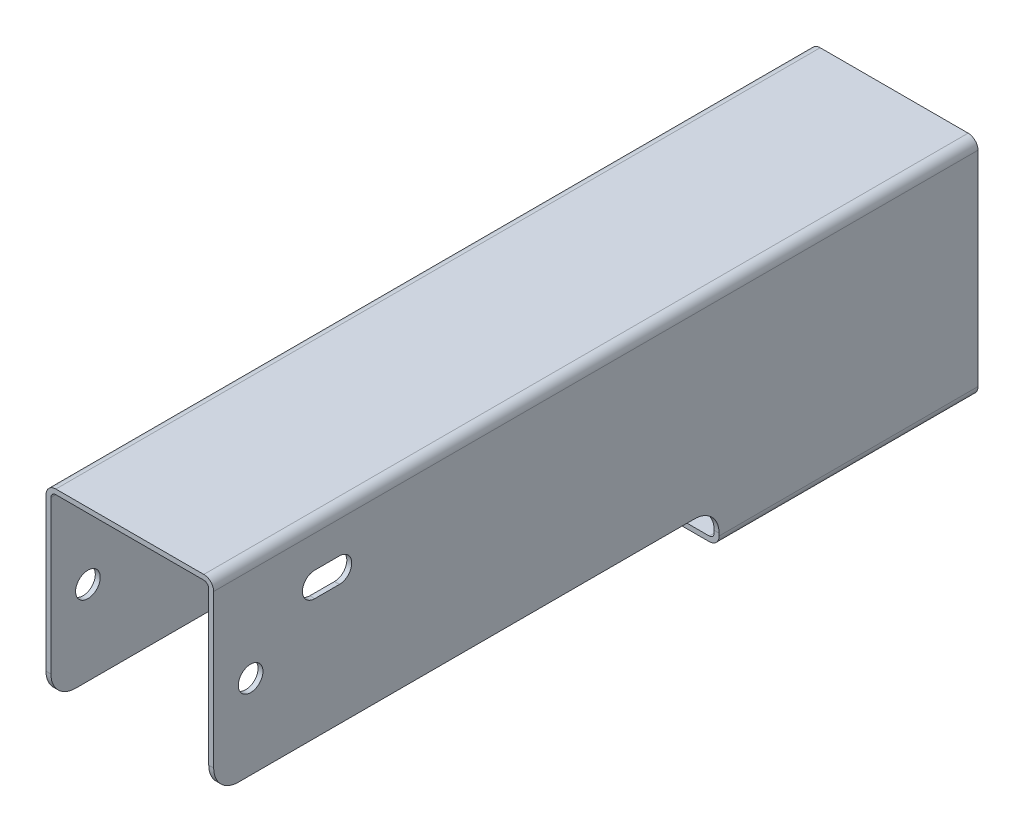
SolidWorks part; units mm, degrees
ref_plane "Plan de face" through (0, 0, 0) normal (0, 0, 1) x (1, 0, 0)
ref_plane "Plan de dessus" through (0, 0, 0) normal (0, 1, 0) x (1, 0, 0)
ref_plane "Plan de droite" through (0, 0, 0) normal (1, 0, 0) x (0, 0, -1)
sketch "Esquisse1" plane through (0, 0, 0) normal (0, 0, 1) x (1, 0, 0)
  line L1 (-32, 0) -> (32, 0)
  line L2 (-32, 0) -> (-32, 2)
  line L3 (-32, 2) -> (32, 2)
  line L4 (32, 0) -> (32, 2)
  dimension "D1" = 2
  dimension "D2" = 64
extrude "Extrusion1" add sketch "Esquisse1" against normal blind 310
sketch "Esquisse2" plane through (0, 2, 0) normal (0, 1, 0) x (-1, 0, 0)
  line L0 (-32, 0) -> (32, 0) construction
  line L1 (-32, 0) -> (-34, 0)
  line L2 (-32, 0) -> (-32, -310)
  line L3 (-32, -310) -> (-34, -310)
  line L4 (-34, 0) -> (-34, -310)
  line L5 (32, -310) -> (34, -310)
  line L6 (32, -310) -> (32, 0)
  line L7 (32, 0) -> (34, 0)
  line L8 (34, -310) -> (34, 0)
  line L11 (-32, -310) -> (32, -310) construction
  dimension "D1" = 2
  dimension "D2" = 2
extrude "Extrusion2" add sketch "Esquisse2" against normal blind 76
fillet "Congé1" radius 2 2 edges
fillet "Congé2" radius 4 2 edges at (34, 2, -155) (-34, 2, -155)
fillet "Congé3" radius 10 2 edges at (-33, -74, 0) (33, -74, 0)
sketch "Esquisse5" plane through (0, 0, -310) normal (0, 0, -1) x (-1, 0, 0)
  line L0 (32, -74) -> (32, -87)
  line L1 (32, -87) -> (-32, -87)
  line L2 (-32, -87) -> (-32, -74)
  line L3 (-34, -74) -> (-34, -89)
  line L4 (-34, -89) -> (34, -89)
  line L5 (34, -89) -> (34, -74)
  line L6 (34, -74) -> (32, -74)
  line L7 (-32, -74) -> (-34, -74)
  dimension "D1" = 2
  dimension "D2" = 85
extrude "Extrusion3" add sketch "Esquisse5" against normal blind 105
fillet "Congé4" radius 2 2 edges at (32, -87, -257.5) (-32, -87, -257.5)
fillet "Congé5" radius 4 2 edges at (34, -89, -257.5) (-34, -89, -257.5)
fillet "Congé6" radius 10 2 edges at (33, -74, -205) (-33, -74, -205)
sketch "Esquisse7" plane through (34, 0, 0) normal (1, 0, 0) x (0, 0, -1)
  line L0 (51, -15) -> (41, -15)
  line L1 (41, -25) -> (51, -25)
  line L2 (0, -64) -> (0, -2) construction
  line L5 (0, -64) -> (0, -2) construction
  line L6 (195, -74) -> (10, -74) construction
  circle A0 centre (15, -40) radius 5
  arc A1 (41, -15) -> (41, -25) centre (41, -20) ccw
  arc A2 (51, -25) -> (51, -15) centre (51, -20) ccw
  dimension "D1" = 10
  dimension "D3" = 5
  dimension "D2" = 10
  dimension "D4" = 41
  dimension "D5" = 15
  dimension "D6" = 34
  dimension "D7" = 20
extrude "Enlèv. mat.-Extru.4" cut sketch "Esquisse7" against normal blind 100
